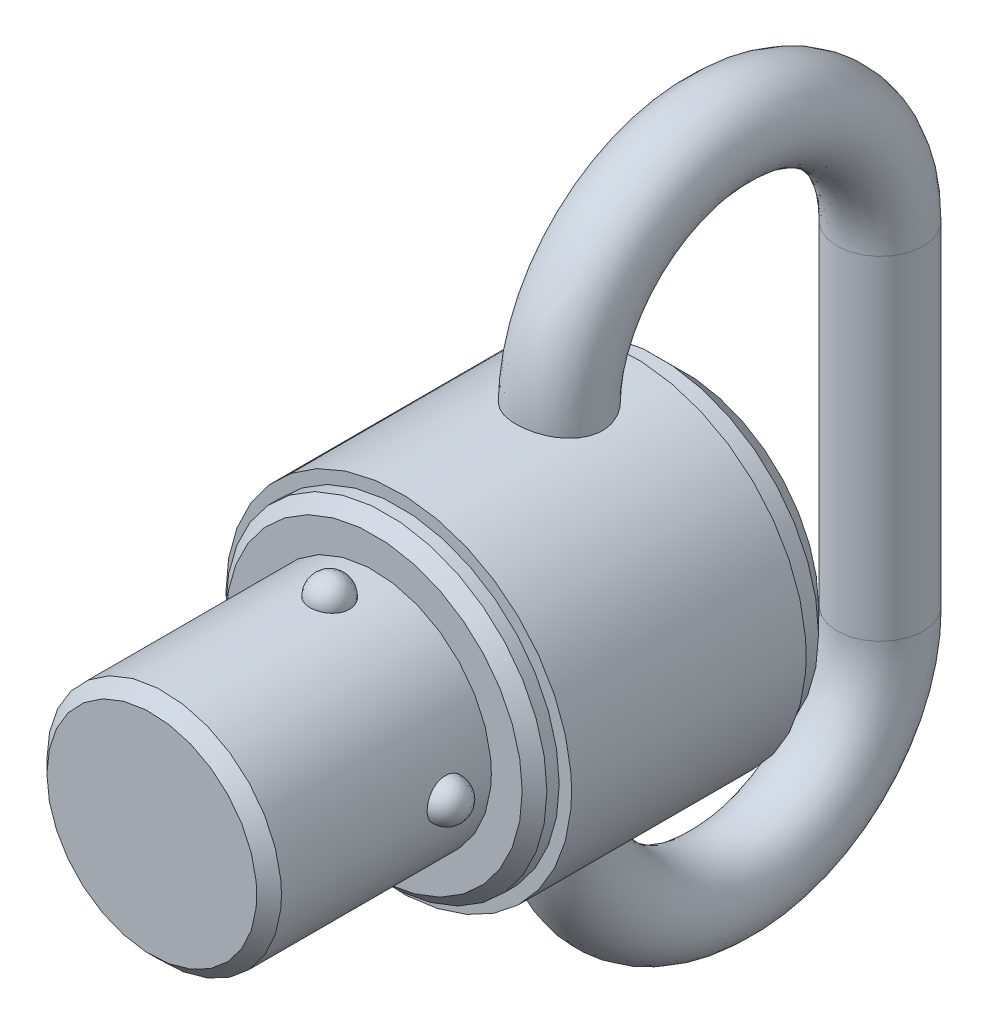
SolidWorks part; units mm, degrees
ref_plane "Front Plane" through (0, 0, 0) normal (0, 0, 1) x (1, 0, 0)
ref_plane "Top Plane" through (0, 0, 0) normal (0, 1, 0) x (1, 0, 0)
ref_plane "Right Plane" through (0, 0, 0) normal (1, 0, 0) x (0, 0, -1)
sketch "Sketch1" plane through (0, 0, 0) normal (0, 0, 1) x (1, 0, 0)
  circle A0 centre (0, 0) radius 7
  dimension "D1" = 14
extrude "Boss-Extrude3" add sketch "Sketch1" along normal mid plane 9.5
sketch "Sketch5" plane through (0, 0, 4.75) normal (0, 0, 1) x (1, 0, 0)
  circle A0 centre (0, 0) radius 6.5
  dimension "D1" = 13
extrude "Boss-Extrude4" add sketch "Sketch5" along normal blind 1
sketch "Sketch6" plane through (0, 0, -4.75) normal (0, 0, -1) x (-1, 0, 0)
  circle A0 centre (0, 0) radius 6.5
  dimension "D1" = 13
extrude "Boss-Extrude5" add sketch "Sketch6" along normal blind 2
chamfer "Chamfer1" distance 1 angle 45 1 edges at (-6.5, 0, -6.75)
sketch "Sketch7" plane through (0, 0, 5.75) normal (0, 0, 1) x (1, 0, 0)
  circle A0 centre (0, 0) radius 4.75
  dimension "D1" = 9.5
extrude "Boss-Extrude6" add sketch "Sketch7" along normal blind 9
sketch "Sketch8" plane through (0, 0, 0) normal (1, 0, 0) x (0, 0, -1)
  line L0 (-22.2378, 0) -> (10.5916, 0) construction
sketch "Sketch9" plane through (0, 0, 0) normal (1, 0, 0) x (0, 0, -1)
  line L0 (-5.75, 4.75) -> (-14.75, 4.75) construction
  line L1 (-8.35, 4.75) -> (-6.75, 4.75)
  line L2 (-5.75, 6.5) -> (-5.75, -6.5) construction
  line L3 (-22.2378, 0) -> (10.5916, 0) construction
  line L5 (-5.75, 4.75) -> (-5.75, -4.75) construction
  arc A0 (-6.75, 4.75) -> (-8.35, 4.75) centre (-7.55, 4.75) ccw
  point P7 (-7.55, 5.55)
  dimension "D1" = 1
  dimension "D2" = 5.55
revolve "Revolve3" add sketch "Sketch9" angle 360 about L1
pattern_circular "CirPattern3" count 4 over 360 about axis through (0, 0, 0) along (0, 0, 1) of "Revolve3"
chamfer "Chamfer2" distance 0.5 angle 45 2 edges at (6.5, 0, 5.75) (4.75, 0, 14.75)
sketch "Sketch11" plane through (0, 0, 0) normal (1, 0, 0) x (0, 0, -1)
  line L0 (16.5, 6.75) -> (16.5, -6.75)
  line L2 (0, -6.75) -> (0, 6.75)
  arc A0 (16.5, 6.75) -> (0, 6.75) centre (8.25, 6.75) ccw
  arc A1 (0, -6.75) -> (16.5, -6.75) centre (8.25, -6.75) ccw
  point P1 (8.25, 15)
  point P2 (0, 6.75)
  point P5 (8.25, -15)
  point P6 (0, -6.75)
  dimension "D1" = 15
  dimension "D3" = 16.5
  dimension "D2" = 15
sketch "Sketch12" plane through (0, 0, 0) normal (0, 1, 0) x (1, 0, 0)
  line L0 (0, 0) -> (0, 16.5) construction
  circle A0 centre (0, 1.75) radius 1.75
  point P4 (0, 0)
  point P5 (0, 0)
  dimension "D1" = 3.5
sweep "Sweep1" add profiles "Sketch12" path "Sketch11"
